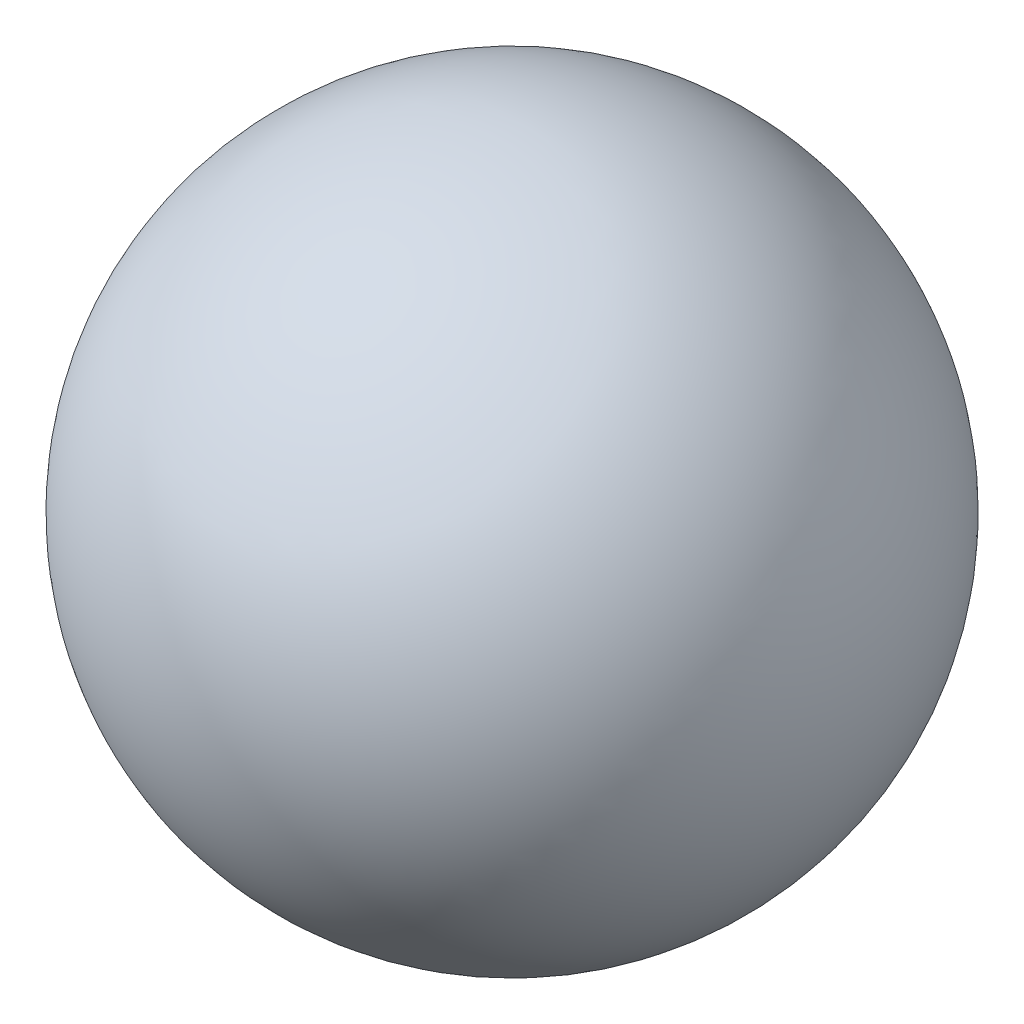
SolidWorks part; units mm, degrees
ref_plane "Front Plane" through (0, 0, 0) normal (0, 0, 1) x (1, 0, 0)
ref_plane "Top Plane" through (0, 0, 0) normal (0, 1, 0) x (1, 0, 0)
ref_plane "Right Plane" through (0, 0, 0) normal (1, 0, 0) x (0, 0, -1)
sketch "Sketch1" plane through (0, 0, 0) normal (0, 1, 0) x (1, 0, 0)
  line L0 (0, -21.335) -> (0, 21.335)
  arc A0 (0, -21.335) -> (0, 21.335) centre (0, 0) ccw
  dimension "D1" = 42.67
revolve "Revolve4" add sketch "Sketch1" angle 360 about L0
